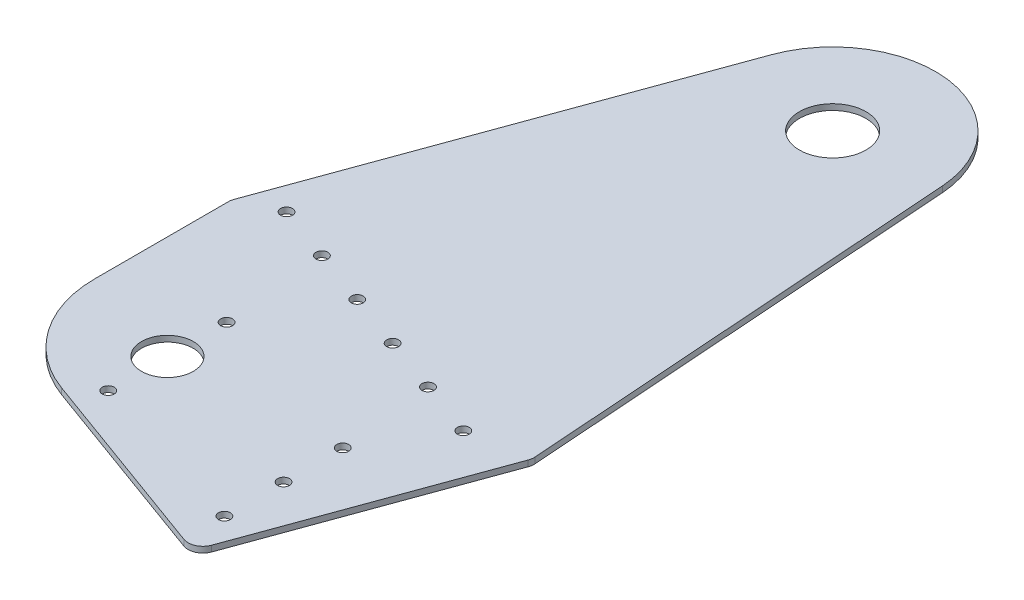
SolidWorks part; units mm, degrees
ref_plane "Front Plane" through (0, 0, 0) normal (0, 0, 1) x (1, 0, 0)
ref_plane "Top Plane" through (0, 0, 0) normal (0, 1, 0) x (1, 0, 0)
ref_plane "Right Plane" through (0, 0, 0) normal (1, 0, 0) x (0, 0, -1)
sketch "Sketch1" plane through (0, 0, 0) normal (0, 1, 0) x (1, 0, 0)
  line L2 (0, 79.9615) -> (0, 137.226)
  line L3 (160.847, 106.8323) -> (8.6873, 162.2139) construction
  line L9 (124.1351, 5.967) -> (160.3844, 105.5611)
  line L11 (0, 138.3457) -> (152.1597, 82.9641) construction
  line L12 (4.3437, 150.2798) -> (156.5034, 94.8982) construction
  line L13 (116.079, 82.9641) -> (116.079, 0) construction
  line L14 (128.779, 6.7641) -> (103.379, 6.7641) construction
  line L15 (128.779, 6.7641) -> (128.779, 82.9641) construction
  line L16 (128.779, 82.9641) -> (103.379, 82.9641) construction
  line L17 (103.379, 6.7641) -> (103.379, 82.9641) construction
  line L18 (128.779, 6.7641) -> (103.379, 82.9641) construction
  line L19 (128.779, 82.9641) -> (103.379, 6.7641) construction
  line L20 (0.383, 139.3979) -> (8.6873, 162.2139)
  line L21 (8.6873, 162.2139) -> (61.8971, 308.4066)
  line L22 (147.4128, 296.4285) -> (160.7514, 108.1817)
  line L23 (33.4254, 32.2252) -> (115.9962, 2.1718)
  line L24 (0, 0) -> (121.9633, 0) construction
  circle A0 centre (103.379, 293.3084) radius 14.2875
  circle A1 centre (44.45, 66.6217) radius 11.1125
  circle A2 centre (44.45, 66.6217) radius 25.4 construction
  circle A3 centre (44.45, 92.0217) radius 2.5527
  circle A4 centre (44.45, 41.2217) radius 2.5527
  circle A5 centre (44.45, 66.6217) radius 31.75 construction
  arc A6 (147.4128, 296.4285) -> (61.8971, 308.4066) centre (103.379, 293.3084) ccw
  arc A9 (0.383, 139.3979) -> (0, 137.226) centre (6.35, 137.226) ccw
  arc A10 (160.3844, 105.5611) -> (160.7514, 108.1817) centre (154.4173, 107.7329) ccw
  arc A11 (115.9962, 2.1718) -> (124.1351, 5.967) centre (118.168, 8.1389) ccw
  arc A12 (0, 79.9615) -> (33.4254, 32.2252) centre (50.8, 79.9615) ccw
  point P3 (111.7505, 111.1869)
  point P14 (135.6187, 102.4996)
  point P20 (116.079, 44.8641)
  point P24 (87.8823, 119.8742)
  point P26 (64.0141, 128.5615)
  point P28 (40.1459, 137.2488)
  point P29 (116.079, 19.4641)
  point P32 (16.2778, 145.9362)
  point P42 (0, 0)
  point P49 (116.079, 70.2641)
  dimension "D2" = 28.575
  dimension "D3" = 22.225
  dimension "D4" = 50.8
  dimension "D5" = 5.1054
  dimension "D21" = 63.5
  dimension "D22" = 6.35
  dimension "D26" = 50.8
  dimension "D6" = 20
  dimension "D7" = 25.4
  dimension "D8" = 23.3807
  dimension "D9" = 161.925
  dimension "D10" = 25.4
  dimension "D11" = 12.7
  dimension "D12" = 155.575
  dimension "D13" = 25.4
  dimension "D14" = 25.4
  dimension "D15" = 25.4
  dimension "D16" = 25.4
  dimension "D17" = 234.221
  dimension "D18" = 44.45
  dimension "D19" = 25.4
  dimension "D20" = 76.2
  dimension "D23" = 25.4
  dimension "D24" = 25.4
  dimension "D25" = 12.7
  dimension "D27" = 77.5957
extrude "Boss-Extrude1" add sketch "Sketch1" along normal blind 2.54
hole_wizard "#7 (0.201) Diameter Hole1" positions "Sketch2" profile "Sketch3" hole size "#7" standard "ANSI Inch"
sketch "Sketch2" plane through (0, 0, 0) normal (0, -1, 0) x (-1, 0, 0)
  point P0 (-135.6187, 102.4996)
  point P3 (-111.7505, 111.1869)
  point P6 (-87.8823, 119.8742)
  point P9 (-64.0141, 128.5615)
  point P12 (-40.1459, 137.2488)
  point P15 (-16.2778, 145.9362)
  point P18 (-116.079, 70.2641)
  point P21 (-116.079, 44.8641)
  point P24 (-116.079, 19.4641)
sketch "Sketch3" plane through (135.6187, 0, -102.4996) normal (1, 0, 0) x (0, 0, -1)
  line L0 (0, 0) -> (0, 2.54)
  line L1 (0, 2.54) -> (2.5527, 2.54)
  line L2 (2.5527, 2.54) -> (2.5527, 0)
  line L5 (2.5527, 0) -> (0, 0)
  line L11 (0, -6.35) -> (0, 107.95) construction
  dimension "Thru Hole Dia." = 5.1054
  dimension "Thru Hole Depth" = 2.54
sketch "Sketch7" [suppressed] plane through (0, 3.175, 0) normal (0, 1, 0) x (1, 0, 0)
  line L0 (62.0761, 169.3899) -> (62.5144, 170.567)
  line L1 (62.5144, 170.567) -> (61.5867, 170.2622)
  line L2 (66.9677, 175.195) -> (66.4796, 174.6886)
  line L3 (79.1731, 159.2722) -> (81.2123, 160.0556)
  line L4 (81.2123, 160.0556) -> (81.5639, 159.3016)
  line L5 (115.2098, 163.8413) -> (116.357, 163.4486)
  line L6 (116.357, 163.4486) -> (115.8813, 162.1889)
  line L7 (107.7827, 167.4695) -> (106.2875, 167.7994)
  line L8 (106.2875, 167.7994) -> (107.2664, 168.7114)
  line L9 (96.7548, 171.953) -> (96.1723, 172.7991)
  line L10 (96.1723, 172.7991) -> (95.6669, 171.9454)
  line L11 (100.3403, 166.7321) -> (97.6686, 163.2228)
  line L12 (89.4476, 166.3552) -> (91.3642, 168.2161)
  line L13 (91.3642, 168.2161) -> (90.6316, 168.886)
  line L14 (14.1169, 177.1315) -> (159.6183, 124.1733) construction
  line L15 (61.8971, 308.4066) -> (0.383, 139.3979) construction
  line L16 (160.7514, 108.1817) -> (147.4128, 296.4285) construction
  line L17 (33.4254, 32.2252) -> (115.9962, 2.1718) construction
  arc A0 (74.3082, 182.8504) -> (73.725, 182.5147) centre (74.7103, 181.4774) ccw
  arc A1 (73.725, 182.5147) -> (72.1718, 181.0017) centre (133.1992, 119.9033) ccw
  arc A2 (72.1718, 181.0017) -> (70.5314, 179.2921) centre (111.5899, 141.5378) ccw
  arc A3 (70.5314, 179.2921) -> (69.0762, 177.6244) centre (101.8392, 150.5038) ccw
  arc A4 (68.547, 177.0625) -> (69.0762, 177.6244) centre (64.4257, 181.474) ccw
  arc A5 (68.1985, 176.9514) -> (68.547, 177.0625) centre (68.2556, 177.3744) ccw
  arc A6 (67.7948, 177.1281) -> (68.1985, 176.9514) centre (68.3059, 177.7466) ccw
  arc A7 (66.8738, 177.9219) -> (67.7948, 177.1281) centre (86.4277, 199.6753) ccw
  arc A8 (66.8738, 177.9219) -> (65.9604, 178.4972) centre (64.7429, 175.5513) ccw
  arc A9 (65.9604, 178.4972) -> (64.9049, 178.7371) centre (64.7273, 175.5134) ccw
  arc A10 (64.9049, 178.7371) -> (63.6726, 178.6312) centre (64.6624, 174.336) ccw
  arc A11 (63.6726, 178.6312) -> (62.2317, 178.1778) centre (65.8385, 169.232) ccw
  arc A12 (62.2317, 178.1778) -> (60.6707, 177.4551) centre (68.6224, 162.3269) ccw
  arc A13 (60.6707, 177.4551) -> (59.5301, 176.703) centre (63.8858, 171.3384) ccw
  arc A14 (59.5301, 176.703) -> (58.5257, 175.7167) centre (64.2391, 170.9033) ccw
  arc A15 (58.5257, 175.7167) -> (57.3864, 174.2438) centre (75.6018, 161.3305) ccw
  arc A16 (56.7062, 173.3435) -> (57.3864, 174.2438) centre (42.2162, 184.9983) ccw
  arc A17 (56.1228, 172.7101) -> (56.7062, 173.3435) centre (51.6914, 177.3771) ccw
  arc A18 (55.5639, 172.2634) -> (56.1228, 172.7101) centre (53.2294, 175.7573) ccw
  arc A19 (54.9666, 171.9461) -> (55.5639, 172.2634) centre (53.6962, 175.0587) ccw
  arc A20 (54.5243, 171.7924) -> (54.9666, 171.9461) centre (53.293, 176.0466) ccw
  arc A21 (54.1163, 171.7066) -> (54.5243, 171.7924) centre (53.7472, 174.4772) ccw
  arc A22 (53.7901, 171.6904) -> (54.1163, 171.7066) centre (53.8553, 173.6659) ccw
  arc A23 (53.635, 171.7688) -> (53.7901, 171.6904) centre (53.7969, 171.8965) ccw
  arc A24 (53.5905, 172.1698) -> (53.635, 171.7688) centre (53.9344, 172.005) ccw
  arc A25 (54.0093, 172.8651) -> (53.5905, 172.1698) centre (57.4392, 170.3253) ccw
  arc A26 (54.9177, 173.9796) -> (54.0093, 172.8651) centre (66.4395, 163.6605) ccw
  arc A27 (56.8324, 176.0866) -> (54.9177, 173.9796) centre (201.8255, 42.4065) ccw
  arc A28 (56.8324, 176.0866) -> (58.6294, 178.1211) centre (10.0366, 219.2312) ccw
  arc A29 (58.6294, 178.1211) -> (59.308, 179.2325) centre (55.3883, 180.8631) ccw
  arc A30 (59.308, 179.2325) -> (59.3329, 180.0542) centre (58.2421, 179.6759) ccw
  arc A31 (59.3329, 180.0542) -> (58.8124, 180.8462) centre (57.5061, 179.4207) ccw
  arc A32 (58.8124, 180.8462) -> (57.7553, 181.5045) centre (56.5222, 178.3469) ccw
  arc A33 (57.7553, 181.5045) -> (56.6586, 181.6278) centre (56.9757, 179.5081) ccw
  arc A34 (56.6586, 181.6278) -> (55.3092, 181.1821) centre (57.2782, 177.4858) ccw
  arc A35 (55.3092, 181.1821) -> (53.3754, 180.0329) centre (66.6249, 159.9392) ccw
  arc A36 (50.4555, 178.11) -> (53.3754, 180.0329) centre (-1623.116, 2722.5471) ccw
  arc A37 (49.9624, 177.8143) -> (50.4555, 178.11) centre (46.648, 183.8988) ccw
  arc A38 (49.9101, 177.875) -> (49.9624, 177.8143) centre (49.9428, 177.8503) ccw
  arc A39 (50.3128, 178.3647) -> (49.9101, 177.875) centre (56.008, 173.2696) ccw
  arc A40 (50.6868, 178.776) -> (50.3128, 178.3647) centre (76.0211, 155.3656) ccw
  arc A41 (51.2355, 179.3665) -> (50.6868, 178.776) centre (157.5463, 80.0316) ccw
  arc A42 (51.843, 180.0132) -> (51.2355, 179.3665) centre (169.196, 69.1464) ccw
  arc A43 (52.4254, 180.6256) -> (51.843, 180.0132) centre (148.4427, 88.7526) ccw
  arc A44 (52.4254, 180.6256) -> (53.4057, 181.7377) centre (39.3118, 193.1732) ccw
  arc A45 (53.4057, 181.7377) -> (53.5985, 182.3391) centre (52.73, 182.286) ccw
  arc A46 (53.5985, 182.3391) -> (53.3133, 182.8365) centre (52.9532, 182.2996) ccw
  arc A47 (53.3133, 182.8365) -> (52.2525, 183.4524) centre (48.0293, 174.9565) ccw
  arc A48 (52.2525, 183.4524) -> (51.5201, 183.784) centre (47.2947, 173.4787) ccw
  arc A49 (51.5201, 183.784) -> (51.1138, 183.8533) centre (51.1621, 182.911) ccw
  arc A50 (51.1138, 183.8533) -> (50.7464, 183.7367) centre (51.1527, 183.0936) ccw
  arc A51 (50.7464, 183.7367) -> (50.2, 183.3471) centre (53.9544, 178.6599) ccw
  arc A52 (50.2, 183.3471) -> (49.7518, 182.9327) centre (52.8985, 179.9782) ccw
  arc A53 (49.7518, 182.9327) -> (49.0516, 182.1629) centre (73.6142, 160.5277) ccw
  arc A54 (49.0516, 182.1629) -> (48.2702, 181.2458) centre (76.593, 157.9039) ccw
  arc A55 (48.2702, 181.2458) -> (47.5086, 180.2915) centre (78.2622, 156.5282) ccw
  arc A56 (46.4851, 179.0185) -> (47.5086, 180.2915) centre (14.0592, 206.1378) ccw
  arc A57 (45.7613, 178.2653) -> (46.4851, 179.0185) centre (40.6676, 183.884) ccw
  arc A58 (45.0854, 177.7635) -> (45.7613, 178.2653) centre (42.8654, 181.4597) ccw
  arc A59 (44.2716, 177.3569) -> (45.0854, 177.7635) centre (42.0649, 182.7925) ccw
  arc A60 (42.4079, 176.7566) -> (44.2716, 177.3569) centre (39.29, 189.6277) ccw
  arc A61 (40.9063, 176.6373) -> (42.4079, 176.7566) centre (41.2837, 181.3973) ccw
  arc A62 (39.9018, 176.9889) -> (40.9063, 176.6373) centre (41.0714, 178.7199) ccw
  arc A63 (39.431, 177.7408) -> (39.9018, 176.9889) centre (40.5148, 177.8961) ccw
  arc A64 (39.5246, 178.6802) -> (39.431, 177.7408) centre (41.3834, 178.0206) ccw
  arc A65 (40.1422, 180.1498) -> (39.5246, 178.6802) centre (52.749, 173.9875) ccw
  arc A66 (40.967, 181.6069) -> (40.1422, 180.1498) centre (52.5933, 174.0636) ccw
  arc A67 (41.8093, 182.6065) -> (40.967, 181.6069) centre (45.3757, 178.7465) ccw
  arc A68 (42.735, 183.3116) -> (41.8093, 182.6065) centre (45.9761, 178.0966) ccw
  arc A69 (43.9637, 183.9848) -> (42.735, 183.3116) centre (49.4769, 172.4638) ccw
  arc A70 (45.1396, 184.492) -> (43.9637, 183.9848) centre (51.0302, 169.2179) ccw
  arc A71 (45.4706, 184.3586) -> (45.1396, 184.492) centre (45.2337, 184.2481) ccw
  arc A72 (45.4918, 184.1987) -> (45.4706, 184.3586) centre (45.2267, 184.2448) ccw
  arc A73 (45.4167, 183.8436) -> (45.4918, 184.1987) centre (40.5531, 185.0579) ccw
  arc A74 (45.2918, 183.4176) -> (45.4167, 183.8436) centre (40.1115, 185.1681) ccw
  arc A75 (45.1216, 182.9606) -> (45.2918, 183.4176) centre (37.7577, 185.9635) ccw
  arc A76 (44.6747, 182.1439) -> (45.1216, 182.9606) centre (41.315, 184.5129) ccw
  arc A77 (44.0662, 181.4742) -> (44.6747, 182.1439) centre (41.6698, 184.2628) ccw
  arc A78 (43.3406, 180.9981) -> (44.0662, 181.4742) centre (41.872, 184.0274) ccw
  arc A79 (42.5496, 180.7503) -> (43.3406, 180.9981) centre (42.1132, 183.5299) ccw
  arc A80 (42.5496, 180.7503) -> (42.0333, 180.6322) centre (43.1444, 176.9613) ccw
  arc A81 (42.0333, 180.6322) -> (41.6424, 180.4565) centre (42.5179, 179.0313) ccw
  arc A82 (41.6424, 180.4565) -> (41.3631, 180.2173) centre (42.2562, 179.4572) ccw
  arc A83 (41.3631, 180.2173) -> (41.1817, 179.91) centre (42.1574, 179.5413) ccw
  arc A84 (41.1817, 179.91) -> (41.3098, 179.5404) centre (41.4675, 179.802) ccw
  arc A85 (41.3098, 179.5404) -> (42.0184, 179.2356) centre (42.7766, 181.9744) ccw
  arc A86 (42.0184, 179.2356) -> (42.9911, 179.0785) centre (43.2169, 183.5653) ccw
  arc A87 (42.9911, 179.0785) -> (43.9333, 179.1484) centre (43.1825, 182.8819) ccw
  arc A88 (43.9333, 179.1484) -> (44.9037, 179.5156) centre (43.3041, 182.2773) ccw
  arc A89 (44.9037, 179.5156) -> (45.7482, 180.1858) centre (43.0455, 182.7238) ccw
  arc A90 (45.7482, 180.1858) -> (46.4656, 181.1717) centre (42.1809, 183.5357) ccw
  arc A91 (46.4656, 181.1717) -> (47.0588, 182.4767) centre (38.3652, 185.6409) ccw
  arc A92 (47.0588, 182.4767) -> (47.3717, 183.6741) centre (40.8285, 184.7444) ccw
  arc A93 (47.3717, 183.6741) -> (47.3128, 184.5787) centre (45.3846, 183.9991) ccw
  arc A94 (47.3128, 184.5787) -> (46.8711, 185.315) centre (45.6402, 184.0759) ccw
  arc A95 (46.8711, 185.315) -> (46.0042, 185.9854) centre (43.743, 182.166) ccw
  arc A96 (46.0042, 185.9854) -> (43.5248, 186.5796) centre (43.802, 182.2657) ccw
  arc A97 (43.5248, 186.5796) -> (40.6936, 185.808) centre (43.994, 179.2776) ccw
  arc A98 (40.6936, 185.808) -> (38.0435, 183.8254) centre (44.996, 177.2948) ccw
  arc A99 (38.0435, 183.8254) -> (36.1073, 180.9839) centre (46.1106, 176.2478) ccw
  arc A100 (35.7666, 180.3077) -> (36.1073, 180.9839) centre (22.1662, 187.5841) ccw
  arc A101 (35.4405, 179.7525) -> (35.7666, 180.3077) centre (28.6157, 184.1336) ccw
  arc A102 (35.1529, 179.3322) -> (35.4405, 179.7525) centre (28.1525, 184.4309) ccw
  arc A103 (35.0212, 179.292) -> (35.1529, 179.3322) centre (35.0603, 179.3996) ccw
  arc A104 (34.8987, 179.3634) -> (35.0212, 179.292) centre (35.1574, 179.6664) ccw
  arc A105 (34.7135, 179.5337) -> (34.8987, 179.3634) centre (37.1267, 181.9726) ccw
  arc A106 (34.5102, 179.7505) -> (34.7135, 179.5337) centre (37.4991, 182.3489) ccw
  arc A107 (34.3152, 179.9906) -> (34.5102, 179.7505) centre (38.0148, 182.7973) ccw
  arc A108 (34.3152, 179.9906) -> (33.9923, 180.3441) centre (32.2157, 178.3978) ccw
  arc A109 (33.9923, 180.3441) -> (33.1472, 181.1013) centre (-7.0589, 135.3727) ccw
  arc A110 (33.1472, 181.1013) -> (32.12, 181.9836) centre (-5.5235, 137.119) ccw
  arc A111 (32.12, 181.9836) -> (30.9902, 182.914) centre (-19.1906, 120.8302) ccw
  arc A112 (29.8644, 183.859) -> (30.9902, 182.914) centre (55.91, 213.7448) ccw
  arc A113 (28.849, 184.7853) -> (29.8644, 183.859) centre (49.7895, 206.7219) ccw
  arc A114 (28.0329, 185.5958) -> (28.849, 184.7853) centre (48.8821, 205.7713) ccw
  arc A115 (27.72, 186.0357) -> (28.0329, 185.5958) centre (29.3248, 186.846) ccw
  arc A116 (27.5634, 187.404) -> (27.72, 186.0357) centre (29.4953, 186.932) ccw
  arc A117 (28.2937, 188.8328) -> (27.5634, 187.404) centre (30.9404, 186.579) ccw
  arc A118 (29.9235, 190.2307) -> (28.2937, 188.8328) centre (33.5403, 184.365) ccw
  arc A119 (32.3635, 191.4887) -> (29.9235, 190.2307) centre (39.3462, 174.9492) ccw
  arc A120 (34.2055, 192.0999) -> (32.3635, 191.4887) centre (37.1375, 180.1808) ccw
  arc A121 (36.2347, 192.4587) -> (34.2055, 192.0999) centre (37.9264, 176.974) ccw
  arc A122 (38.0495, 192.5388) -> (36.2347, 192.4587) centre (37.761, 178.4879) ccw
  arc A123 (39.0536, 192.2197) -> (38.0495, 192.5388) centre (38.0113, 190.6797) ccw
  arc A124 (39.401, 191.9318) -> (39.0536, 192.2197) centre (37.7469, 190.289) ccw
  arc A125 (39.5146, 191.678) -> (39.401, 191.9318) centre (39.1218, 191.6545) ccw
  arc A126 (39.4565, 191.3418) -> (39.5146, 191.678) centre (38.7713, 191.6335) ccw
  arc A127 (39.1465, 190.6692) -> (39.4565, 191.3418) centre (27.8847, 196.2671) ccw
  arc A128 (38.0069, 188.9592) -> (39.1465, 190.6692) centre (31.8572, 194.2925) ccw
  arc A129 (36.3742, 187.4082) -> (38.0069, 188.9592) centre (29.1898, 196.6058) ccw
  arc A130 (34.4963, 186.2162) -> (36.3742, 187.4082) centre (29.3429, 196.4098) ccw
  arc A131 (32.6257, 185.5753) -> (34.4963, 186.2162) centre (31.2535, 192.6306) ccw
  arc A132 (32.6257, 185.5753) -> (32.326, 185.4734) centre (32.849, 184.4267) ccw
  arc A133 (32.326, 185.4734) -> (32.1971, 185.3132) centre (32.4364, 185.2526) ccw
  arc A134 (32.1971, 185.3132) -> (32.187, 185.0278) centre (32.8524, 185.1473) ccw
  arc A135 (32.187, 185.0278) -> (32.3205, 184.3701) centre (46.8553, 187.6615) ccw
  arc A136 (32.3205, 184.3701) -> (32.6327, 183.5397) centre (35.4909, 185.088) ccw
  arc A137 (32.6327, 183.5397) -> (33.1345, 182.9292) centre (34.4573, 184.5281) ccw
  arc A138 (33.1345, 182.9292) -> (33.7845, 182.5919) centre (34.2412, 184.2668) ccw
  arc A139 (33.7845, 182.5919) -> (34.5255, 182.546) centre (34.2659, 184.3575) ccw
  arc A140 (34.5255, 182.546) -> (36.1223, 183.2401) centre (34.0587, 185.8032) ccw
  arc A141 (36.1223, 183.2401) -> (38.2538, 185.2006) centre (22.3005, 200.4074) ccw
  arc A142 (38.2538, 185.2006) -> (40.2061, 187.5541) centre (22.1985, 200.5047) ccw
  arc A143 (40.2061, 187.5541) -> (41.3352, 189.6901) centre (33.0357, 192.7108) ccw
  arc A144 (41.3352, 189.6901) -> (41.6737, 191.3689) centre (35.9537, 191.6488) ccw
  arc A145 (41.6737, 191.3689) -> (41.4198, 192.8507) centre (38.2108, 191.5384) ccw
  arc A146 (41.4198, 192.8507) -> (40.543, 194.1499) centre (37.865, 191.397) ccw
  arc A147 (40.543, 194.1499) -> (39.0445, 195.2909) centre (35.0939, 188.5481) ccw
  arc A148 (39.0445, 195.2909) -> (36.5392, 195.9699) centre (36.5427, 191.021) ccw
  arc A149 (36.5392, 195.9699) -> (32.9739, 195.586) centre (36.5513, 179.1093) ccw
  arc A150 (32.9739, 195.586) -> (29.3635, 194.3985) centre (36.8595, 177.6898) ccw
  arc A151 (29.3635, 194.3985) -> (26.6543, 192.6008) centre (33.4359, 185.3211) ccw
  arc A152 (26.6543, 192.6008) -> (24.9307, 190.1375) centre (31.5632, 187.3313) ccw
  arc A153 (24.9307, 190.1375) -> (24.6835, 187.5211) centre (28.9468, 188.4382) ccw
  arc A154 (24.6835, 187.5211) -> (26.0207, 184.7839) centre (30.8844, 188.8551) ccw
  arc A155 (26.0207, 184.7839) -> (28.9405, 181.9734) centre (40.4964, 196.9008) ccw
  arc A156 (29.9885, 181.128) -> (28.9405, 181.9734) centre (8.4014, 155.4417) ccw
  arc A157 (30.3575, 180.6787) -> (29.9885, 181.128) centre (28.9675, 179.9132) ccw
  arc A158 (30.3713, 180.3133) -> (30.3575, 180.6787) centre (30.0009, 180.4823) ccw
  arc A159 (30.0759, 179.9118) -> (30.3713, 180.3133) centre (29.2641, 180.8183) ccw
  arc A160 (28.5512, 179.2654) -> (30.0759, 179.9118) centre (28.3681, 181.8189) ccw
  arc A161 (25.8887, 179.3109) -> (28.5512, 179.2654) centre (27.4758, 194.2586) ccw
  arc A162 (23.2563, 179.8312) -> (25.8887, 179.3109) centre (27.4762, 194.2617) ccw
  arc A163 (21.8803, 180.7864) -> (23.2563, 179.8312) centre (23.9984, 182.369) ccw
  arc A164 (21.8803, 180.7864) -> (21.4146, 181.3746) centre (11.131, 172.7548) ccw
  arc A165 (21.4146, 181.3746) -> (21.194, 181.4707) centre (21.208, 181.2014) ccw
  arc A166 (21.194, 181.4707) -> (20.9847, 181.3519) centre (21.2079, 181.2022) ccw
  arc A167 (20.9847, 181.3519) -> (20.5852, 180.7185) centre (32.0578, 173.9268) ccw
  arc A168 (20.5852, 180.7185) -> (20.5596, 178.2742) centre (22.6871, 179.4742) ccw
  arc A169 (20.5596, 178.2742) -> (22.7566, 176.3693) centre (24.3256, 180.3983) ccw
  arc A170 (22.7566, 176.3693) -> (26.8636, 175.665) centre (26.5339, 186.0688) ccw
  arc A171 (26.8636, 175.665) -> (31.4496, 176.4875) centre (26.3557, 191.6925) ccw
  arc A172 (32.2098, 176.7264) -> (31.4496, 176.4875) centre (38.1788, 156.4012) ccw
  arc A173 (33.0182, 176.9497) -> (32.2098, 176.7264) centre (39.5156, 151.8489) ccw
  arc A174 (33.7585, 177.1285) -> (33.0182, 176.9497) centre (38.8624, 154.3726) ccw
  arc A175 (34.2819, 177.2207) -> (33.7585, 177.1285) centre (35.0169, 171.5178) ccw
  arc A176 (34.9396, 177.2772) -> (34.2819, 177.2207) centre (35.2749, 169.5161) ccw
  arc A177 (35.2649, 177.2034) -> (34.9396, 177.2772) centre (34.967, 176.6436) ccw
  arc A178 (35.5206, 176.9724) -> (35.2649, 177.2034) centre (34.9322, 176.5782) ccw
  arc A179 (35.9024, 176.3582) -> (35.5206, 176.9724) centre (26.6812, 171.0512) ccw
  arc A180 (35.9024, 176.3582) -> (36.9988, 175.1864) centre (38.9535, 178.1142) ccw
  arc A181 (36.9988, 175.1864) -> (38.571, 174.5314) centre (39.4525, 178.8615) ccw
  arc A182 (38.571, 174.5314) -> (40.5484, 174.4493) centre (39.8152, 180.6435) ccw
  arc A183 (40.5484, 174.4493) -> (42.8178, 174.9505) centre (39.1738, 186.0622) ccw
  arc A184 (43.3201, 175.1069) -> (42.8178, 174.9505) centre (48.2695, 158.3264) ccw
  arc A185 (43.7701, 175.2291) -> (43.3201, 175.1069) centre (46.3835, 164.7208) ccw
  arc A186 (44.1476, 175.3175) -> (43.7701, 175.2291) centre (47.1628, 161.587) ccw
  arc A187 (44.2628, 175.3098) -> (44.1476, 175.3175) centre (44.192, 175.1153) ccw
  arc A188 (44.3107, 175.241) -> (44.2628, 175.3098) centre (44.2379, 175.2415) ccw
  arc A189 (44.2954, 175.0356) -> (44.3107, 175.241) centre (42.7889, 175.2514) ccw
  arc A190 (44.2393, 174.7674) -> (44.2954, 175.0356) centre (42.1713, 175.3398) ccw
  arc A191 (44.1412, 174.4607) -> (44.2393, 174.7674) centre (40.311, 175.8548) ccw
  arc A192 (44.1412, 174.4607) -> (44.0089, 173.708) centre (46.203, 173.7103) ccw
  arc A193 (44.0089, 173.708) -> (44.1385, 172.9419) centre (46.3511, 173.7104) ccw
  arc A194 (44.1385, 172.9419) -> (44.5028, 172.2883) centre (46.1785, 173.6505) ccw
  arc A195 (44.5028, 172.2883) -> (45.0452, 171.8581) centre (45.7458, 173.2987) ccw
  arc A196 (45.0452, 171.8581) -> (45.5046, 171.7887) centre (45.3862, 172.5592) ccw
  arc A197 (45.5046, 171.7887) -> (46.0003, 171.9763) centre (45.311, 173.0486) ccw
  arc A198 (46.0003, 171.9763) -> (46.7213, 172.5276) centre (42.9825, 176.6707) ccw
  arc A199 (46.7213, 172.5276) -> (48.1908, 173.8802) centre (-21.0634, 247.6437) ccw
  arc A200 (49.9531, 175.4754) -> (48.1908, 173.8802) centre (92.8617, 126.3005) ccw
  arc A201 (51.74, 176.975) -> (49.9531, 175.4754) centre (89.7982, 129.8115) ccw
  arc A202 (53.4092, 178.3032) -> (51.74, 176.975) centre (149.5534, 55.76) ccw
  arc A203 (53.7366, 178.3554) -> (53.4092, 178.3032) centre (53.6199, 178.0346) ccw
  arc A204 (53.756, 178.2996) -> (53.7366, 178.3554) centre (53.7236, 178.3196) ccw
  arc A205 (53.4455, 177.8028) -> (53.756, 178.2996) centre (14.1169, 202.725) ccw
  arc A206 (53.0612, 177.2191) -> (53.4455, 177.8028) centre (36.5165, 188.5306) ccw
  arc A207 (52.5822, 176.5337) -> (53.0612, 177.2191) centre (19.3352, 200.2773) ccw
  arc A208 (52.5822, 176.5337) -> (51.6189, 175.0333) centre (67.2678, 166.0458) ccw
  arc A209 (51.6189, 175.0333) -> (50.8843, 173.5493) centre (63.2726, 168.3404) ccw
  arc A210 (50.8843, 173.5493) -> (50.4332, 172.233) centre (60.3416, 169.5728) ccw
  arc A211 (50.4332, 172.233) -> (50.3764, 171.2877) centre (52.709, 171.622) ccw
  arc A212 (50.3764, 171.2877) -> (50.8293, 170.4134) centre (51.8564, 171.4998) ccw
  arc A213 (50.8293, 170.4134) -> (51.7794, 169.8973) centre (52.2752, 171.9427) ccw
  arc A214 (51.7794, 169.8973) -> (53.1461, 169.8276) centre (52.647, 173.4767) ccw
  arc A215 (53.1461, 169.8276) -> (54.7542, 170.2266) centre (52.0974, 177.4948) ccw
  arc A216 (55.3189, 170.4157) -> (54.7542, 170.2266) centre (58.4979, 159.9846) ccw
  arc A217 (55.6177, 170.4524) -> (55.3189, 170.4157) centre (55.573, 169.5819) ccw
  arc A218 (55.7691, 170.3669) -> (55.6177, 170.4524) centre (55.6077, 170.2581) ccw
  arc A219 (55.8258, 170.1715) -> (55.7691, 170.3669) centre (55.4927, 170.1806) ccw
  arc A220 (55.8258, 170.1715) -> (55.8514, 169.9319) centre (56.7312, 170.1468) ccw
  arc A221 (55.8514, 169.9319) -> (55.9579, 169.5508) centre (61.6551, 171.3493) ccw
  arc A222 (55.9579, 169.5508) -> (56.1102, 169.1191) centre (62.5193, 171.6221) ccw
  arc A223 (56.1102, 169.1191) -> (56.2928, 168.6924) centre (62.8661, 171.7576) ccw
  arc A224 (56.2928, 168.6924) -> (57.4829, 167.4515) centre (58.71, 169.8196) ccw
  arc A225 (57.4829, 167.4515) -> (59.2339, 167.1346) centre (58.8722, 170.1326) ccw
  arc A226 (59.2339, 167.1346) -> (60.9662, 167.8594) centre (58.8215, 170.5531) ccw
  arc A227 (60.9662, 167.8594) -> (62.0761, 169.3899) centre (58.7665, 170.6222) ccw
  arc A228 (60.6138, 170.7928) -> (61.5867, 170.2622) centre (61.3494, 170.9844) ccw
  arc A229 (60.8154, 172.4171) -> (60.6138, 170.7928) centre (62.7575, 171.3513) ccw
  arc A230 (62.6398, 174.8337) -> (60.8154, 172.4171) centre (70.0177, 167.367) ccw
  arc A231 (64.8718, 176.2485) -> (62.6398, 174.8337) centre (67.003, 170.418) ccw
  arc A232 (65.3282, 176.4029) -> (64.8718, 176.2485) centre (68.2976, 166.8761) ccw
  arc A233 (65.749, 176.5194) -> (65.3282, 176.4029) centre (67.3605, 169.8827) ccw
  arc A234 (66.1032, 176.5955) -> (65.749, 176.5194) centre (67.3446, 169.9483) ccw
  arc A235 (66.2518, 176.5832) -> (66.1032, 176.5955) centre (66.1551, 176.3175) ccw
  arc A236 (66.44, 176.4345) -> (66.2518, 176.5832) centre (66.1213, 176.2247) ccw
  arc A237 (66.7316, 175.9559) -> (66.44, 176.4345) centre (59.7592, 172.036) ccw
  arc A238 (66.9914, 175.457) -> (66.7316, 175.9559) centre (59.0868, 171.658) ccw
  arc A239 (67.0017, 175.2495) -> (66.9914, 175.457) centre (66.7501, 175.3411) ccw
  arc A240 (66.9677, 175.195) -> (67.0017, 175.2495) centre (66.8559, 175.3025) ccw
  arc A241 (65.9217, 174.1157) -> (66.4796, 174.6886) centre (-0.3358, 239.1998) ccw
  arc A242 (65.2645, 173.4503) -> (65.9217, 174.1157) centre (-57.3273, 295.182) ccw
  arc A243 (65.2645, 173.4503) -> (64.0677, 172.1499) centre (81.8084, 157.0225) ccw
  arc A244 (64.0677, 172.1499) -> (63.4286, 171.1774) centre (67.6274, 169.1145) ccw
  arc A245 (63.4286, 171.1774) -> (63.0742, 170.1165) centre (67.1785, 169.3351) ccw
  arc A246 (63.0742, 170.1165) -> (62.8538, 168.5433) centre (79.0298, 167.0787) ccw
  arc A247 (62.8538, 168.5433) -> (62.9704, 166.7394) centre (68.6902, 168.0148) ccw
  arc A248 (62.9704, 166.7394) -> (63.6889, 165.5617) centre (65.0575, 167.2048) ccw
  arc A249 (63.6889, 165.5617) -> (64.9741, 165.071) centre (65.0485, 167.194) ccw
  arc A250 (64.9741, 165.071) -> (66.7601, 165.2889) centre (65.1764, 170.8417) ccw
  arc A251 (67.3237, 165.441) -> (66.7601, 165.2889) centre (72.4207, 145.443) ccw
  arc A252 (67.8029, 165.5512) -> (67.3237, 165.441) centre (69.904, 155.3172) ccw
  arc A253 (68.2017, 165.6286) -> (67.8029, 165.5512) centre (71.5525, 147.2877) ccw
  arc A254 (68.2539, 165.5956) -> (68.2017, 165.6286) centre (68.2099, 165.5838) ccw
  arc A255 (68.2632, 165.5138) -> (68.2539, 165.5956) centre (67.9851, 165.5235) ccw
  arc A256 (68.2486, 165.1392) -> (68.2632, 165.5138) centre (18.2975, 167.2726) ccw
  arc A257 (68.2263, 164.699) -> (68.2486, 165.1392) centre (40.5629, 166.3217) ccw
  arc A258 (68.1942, 164.1979) -> (68.2263, 164.699) centre (21.7421, 167.4257) ccw
  arc A259 (68.1942, 164.1979) -> (68.2557, 162.9509) centre (73.4553, 163.8323) ccw
  arc A260 (68.2557, 162.9509) -> (68.6061, 161.6871) centre (74.5732, 164.0218) ccw
  arc A261 (68.6061, 161.6871) -> (69.1861, 160.5706) centre (74.1315, 163.849) ccw
  arc A262 (69.1861, 160.5706) -> (69.9292, 159.7637) centre (72.0774, 162.4873) ccw
  arc A263 (69.9292, 159.7637) -> (71.0506, 159.11) centre (72.8077, 163.4132) ccw
  arc A264 (71.0506, 159.11) -> (72.6135, 158.5966) centre (75.4812, 169.9608) ccw
  arc A265 (72.6135, 158.5966) -> (74.2686, 158.2998) centre (75.5651, 170.2933) ccw
  arc A266 (74.2686, 158.2998) -> (75.6874, 158.3104) centre (74.932, 164.4372) ccw
  arc A267 (75.6874, 158.3104) -> (76.3847, 158.4332) centre (74.8472, 165.1251) ccw
  arc A268 (76.3847, 158.4332) -> (77.308, 158.6665) centre (71.4689, 179.8295) ccw
  arc A269 (77.308, 158.6665) -> (78.2865, 158.9591) centre (70.9596, 181.6752) ccw
  arc A270 (78.2865, 158.9591) -> (79.1731, 159.2722) centre (73.0176, 175.2945) ccw
  arc A271 (81.5639, 159.3016) -> (82.0723, 158.5817) centre (83.8133, 160.3506) ccw
  arc A272 (82.0723, 158.5817) -> (82.8503, 157.998) centre (84.6282, 161.1785) ccw
  arc A273 (82.8503, 157.998) -> (83.7221, 157.6587) centre (84.503, 160.9544) ccw
  arc A274 (83.7221, 157.6587) -> (84.5041, 157.658) centre (84.1145, 159.3147) ccw
  arc A275 (84.5041, 157.658) -> (84.898, 157.7963) centre (84.055, 159.5674) ccw
  arc A276 (84.898, 157.7963) -> (85.4779, 158.094) centre (80.2438, 167.5753) ccw
  arc A277 (85.4779, 158.094) -> (86.1162, 158.4718) centre (79.4906, 168.9396) ccw
  arc A278 (86.1162, 158.4718) -> (86.7275, 158.8854) centre (79.669, 168.6578) ccw
  arc A279 (87.2967, 159.2808) -> (86.7275, 158.8854) centre (97.7406, 143.6379) ccw
  arc A280 (87.8098, 159.6034) -> (87.2967, 159.2808) centre (93.4193, 150.1105) ccw
  arc A281 (88.2441, 159.8499) -> (87.8098, 159.6034) centre (95.1182, 147.2354) ccw
  arc A282 (88.3811, 159.8626) -> (88.2441, 159.8499) centre (88.3273, 159.6972) ccw
  arc A283 (88.4414, 159.7807) -> (88.3811, 159.8626) centre (88.3541, 159.7795) ccw
  arc A284 (88.427, 159.5386) -> (88.4414, 159.7807) centre (86.7915, 159.7576) ccw
  arc A285 (88.3624, 159.22) -> (88.427, 159.5386) centre (86.0178, 159.8612) ccw
  arc A286 (88.2462, 158.8546) -> (88.3624, 159.22) centre (83.8571, 160.4521) ccw
  arc A287 (88.2462, 158.8546) -> (88.1272, 158.3962) centre (90.5899, 158.0016) ccw
  arc A288 (88.1272, 158.3962) -> (88.0913, 157.9067) centre (90.9602, 157.9422) ccw
  arc A289 (88.0913, 157.9067) -> (88.1393, 157.4142) centre (91.0105, 157.9429) ccw
  arc A290 (88.1393, 157.4142) -> (88.2697, 156.946) centre (90.8101, 157.906) ccw
  arc A291 (88.2697, 156.946) -> (88.5079, 156.4198) centre (92.5095, 158.5481) ccw
  arc A292 (88.5079, 156.4198) -> (88.7537, 156.1203) centre (89.3753, 156.8811) ccw
  arc A293 (88.7537, 156.1203) -> (89.0958, 155.9389) centre (89.378, 156.8844) ccw
  arc A294 (89.0958, 155.9389) -> (89.6608, 155.8086) centre (90.4086, 160.338) ccw
  arc A295 (89.6608, 155.8086) -> (90.1565, 155.7817) centre (90.0307, 158.0495) ccw
  arc A296 (90.1565, 155.7817) -> (90.8132, 155.8497) centre (89.7737, 162.6832) ccw
  arc A297 (90.8132, 155.8497) -> (91.5106, 155.9893) centre (89.6645, 163.4011) ccw
  arc A298 (91.5106, 155.9893) -> (92.1441, 156.1863) centre (90.1128, 161.6014) ccw
  arc A299 (93.2212, 156.5738) -> (92.1441, 156.1863) centre (107.0085, 116.5611) ccw
  arc A300 (93.653, 156.6471) -> (93.2212, 156.5738) centre (93.6592, 155.3025) ccw
  arc A301 (93.8054, 156.5151) -> (93.653, 156.6471) centre (93.6537, 156.494) ccw
  arc A302 (93.7714, 156.1938) -> (93.8054, 156.5151) centre (93.1422, 156.4228) ccw
  arc A303 (93.7714, 156.1938) -> (93.7529, 155.6122) centre (94.648, 155.8748) ccw
  arc A304 (93.7529, 155.6122) -> (94.0829, 154.8096) centre (97.7329, 156.7795) ccw
  arc A305 (94.0829, 154.8096) -> (94.5832, 154.0778) centre (97.8126, 156.8225) ccw
  arc A306 (94.5832, 154.0778) -> (95.112, 153.71) centre (95.5427, 154.8932) ccw
  arc A307 (95.112, 153.71) -> (96.1172, 153.5975) centre (95.8467, 155.7286) ccw
  arc A308 (96.1172, 153.5975) -> (97.5577, 153.9024) centre (94.9894, 162.4836) ccw
  arc A309 (97.5577, 153.9024) -> (99.0889, 154.4962) centre (94.5811, 163.8479) ccw
  arc A310 (99.0889, 154.4962) -> (100.4205, 155.2988) centre (95.4623, 162.0198) ccw
  arc A311 (100.4205, 155.2988) -> (101.005, 155.7598) centre (93.571, 164.5834) ccw
  arc A312 (101.005, 155.7598) -> (101.4861, 156.2055) centre (96.5124, 161.0922) ccw
  arc A313 (101.4861, 156.2055) -> (101.8369, 156.5933) centre (96.9623, 160.6501) ccw
  arc A314 (101.8369, 156.5933) -> (101.8862, 156.7905) centre (101.657, 156.743) ccw
  arc A315 (101.8862, 156.7905) -> (101.6772, 157.1413) centre (101.2743, 156.6636) ccw
  arc A316 (101.6772, 157.1413) -> (101.3093, 157.2626) centre (101.3422, 156.7441) ccw
  arc A317 (101.3093, 157.2626) -> (100.7828, 157.1091) centre (101.3888, 156.0107) ccw
  arc A318 (100.7828, 157.1091) -> (100.1358, 156.6795) centre (103.0724, 152.9588) ccw
  arc A319 (99.2924, 156.1129) -> (100.1358, 156.6795) centre (96.0217, 161.8922) ccw
  arc A320 (98.3794, 155.687) -> (99.2924, 156.1129) centre (96.1294, 161.7019) ccw
  arc A321 (97.5854, 155.4596) -> (98.3794, 155.687) centre (96.5488, 160.5808) ccw
  arc A322 (97.2265, 155.5913) -> (97.5854, 155.4596) centre (97.513, 155.8174) ccw
  arc A323 (97.1513, 156.3756) -> (97.2265, 155.5913) centre (97.7972, 156.0417) ccw
  arc A324 (98.3117, 158.4158) -> (97.1513, 156.3756) centre (123.2009, 142.9097) ccw
  arc A325 (100.0065, 160.8692) -> (98.3117, 158.4158) centre (125.0369, 141.7659) ccw
  arc A326 (102.1792, 163.5408) -> (100.0065, 160.8692) centre (144.3604, 127.018) ccw
  arc A327 (103.5171, 165.0485) -> (102.1792, 163.5408) centre (164.7872, 109.3315) ccw
  arc A328 (104.2773, 165.7708) -> (103.5171, 165.0485) centre (108.8368, 160.211) ccw
  arc A329 (104.8168, 166.0837) -> (104.2773, 165.7708) centre (105.5083, 164.2697) ccw
  arc A330 (105.2843, 166.0873) -> (104.8168, 166.0837) centre (105.0553, 165.458) ccw
  arc A331 (105.3465, 165.9273) -> (105.2843, 166.0873) centre (105.2453, 165.98) ccw
  arc A332 (105.0939, 165.5331) -> (105.3465, 165.9273) centre (103.0097, 167.1464) ccw
  arc A333 (104.5868, 164.9464) -> (105.0939, 165.5331) centre (99.4276, 169.919) ccw
  arc A334 (103.7536, 164.1096) -> (104.5868, 164.9464) centre (78.4434, 190.1439) ccw
  arc A335 (103.7536, 164.1096) -> (102.3738, 162.6584) centre (121.5081, 145.8473) ccw
  arc A336 (102.3738, 162.6584) -> (101.6815, 161.5964) centre (105.712, 159.7254) ccw
  arc A337 (101.6815, 161.5964) -> (101.4294, 160.5657) centre (104.1682, 160.4421) ccw
  arc A338 (101.4294, 160.5657) -> (101.5169, 159.2913) centre (107.0552, 160.3118) ccw
  arc A339 (101.5169, 159.2913) -> (102.0068, 157.7779) centre (107.5122, 160.396) ccw
  arc A340 (102.0068, 157.7779) -> (102.9056, 156.2974) centre (109.7048, 161.4387) ccw
  arc A341 (102.9056, 156.2974) -> (104.2497, 154.8037) centre (112.3119, 163.41) ccw
  arc A342 (104.2497, 154.8037) -> (106.0867, 153.2478) centre (120.7155, 172.3809) ccw
  arc A343 (107.1588, 152.2758) -> (106.0867, 153.2478) centre (100.8303, 146.373) ccw
  arc A344 (107.2427, 151.6389) -> (107.1588, 152.2758) centre (106.7543, 151.8985) ccw
  arc A345 (106.625, 151.1698) -> (107.2427, 151.6389) centre (106.4259, 152.0731) ccw
  arc A346 (104.8179, 150.8612) -> (106.625, 151.1698) centre (102.4977, 169.8959) ccw
  arc A347 (102.932, 150.7695) -> (104.8179, 150.8612) centre (103.2457, 163.759) ccw
  arc A348 (101.2302, 150.9765) -> (102.932, 150.7695) centre (103.146, 159.6295) ccw
  arc A349 (99.8263, 151.4569) -> (101.2302, 150.9765) centre (102.6676, 157.4686) ccw
  arc A350 (98.8346, 152.1859) -> (99.8263, 151.4569) centre (101.2015, 154.3666) ccw
  arc A351 (98.8346, 152.1859) -> (98.2533, 152.7414) centre (94.1824, 147.8996) ccw
  arc A352 (98.2533, 152.7414) -> (97.9025, 152.8128) centre (98.0124, 152.455) ccw
  arc A353 (97.9025, 152.8128) -> (97.6086, 152.5576) centre (98.0436, 152.3534) ccw
  arc A354 (97.6086, 152.5576) -> (97.2521, 151.7001) centre (106.9734, 148.1619) ccw
  arc A355 (97.2521, 151.7001) -> (97.5139, 149.4925) centre (99.5718, 150.8558) ccw
  arc A356 (97.5139, 149.4925) -> (99.5568, 147.833) centre (101.185, 151.9245) ccw
  arc A357 (99.5568, 147.833) -> (103.1248, 147.1564) centre (103.0872, 156.7047) ccw
  arc A358 (103.1248, 147.1564) -> (107.3336, 147.6883) centre (103.0561, 164.6175) ccw
  arc A359 (107.3336, 147.6883) -> (108.1157, 147.8984) centre (100.7179, 173.8716) ccw
  arc A360 (108.1157, 147.8984) -> (108.8582, 148.1237) centre (101.8914, 169.7516) ccw
  arc A361 (108.8582, 148.1237) -> (109.4811, 148.3352) centre (102.4455, 168.0313) ccw
  arc A362 (109.4811, 148.3352) -> (109.7929, 148.4805) centre (108.8578, 150.0801) ccw
  arc A363 (110.551, 148.7041) -> (109.7929, 148.4805) centre (110.6245, 147.058) ccw
  arc A364 (111.4377, 148.592) -> (110.551, 148.7041) centre (110.6686, 146.0707) ccw
  arc A365 (112.3117, 148.1686) -> (111.4377, 148.592) centre (110.5204, 145.5849) ccw
  arc A366 (113.0306, 147.4929) -> (112.3117, 148.1686) centre (110.4085, 145.4234) ccw
  arc A367 (113.0306, 147.4929) -> (114.0876, 146.5636) centre (116.0922, 149.9093) ccw
  arc A368 (114.0876, 146.5636) -> (115.4418, 146.0301) centre (116.3711, 150.3749) ccw
  arc A369 (115.4418, 146.0301) -> (117.0635, 145.9201) centre (116.6348, 151.6077) ccw
  arc A370 (117.0635, 145.9201) -> (118.9045, 146.2365) centre (116.3233, 155.7421) ccw
  arc A371 (119.6917, 146.4433) -> (118.9045, 146.2365) centre (131.9567, 98.1706) ccw
  arc A372 (120.3794, 146.609) -> (119.6917, 146.4433) centre (126.7001, 118.8596) ccw
  arc A373 (120.9676, 146.7397) -> (120.3794, 146.609) centre (133.1775, 90.4219) ccw
  arc A374 (121.0804, 146.7321) -> (120.9676, 146.7397) centre (121.0107, 146.5407) ccw
  arc A375 (121.1231, 146.6671) -> (121.0804, 146.7321) centre (121.0581, 146.6709) ccw
  arc A376 (121.0986, 146.4529) -> (121.1231, 146.6671) centre (119.1481, 146.784) ccw
  arc A377 (121.0356, 146.1763) -> (121.0986, 146.4529) centre (118.6024, 146.8766) ccw
  arc A378 (120.9321, 145.8584) -> (121.0356, 146.1763) centre (116.3671, 147.5199) ccw
  arc A379 (120.9321, 145.8584) -> (120.8158, 145.1098) centre (122.7691, 145.1898) ccw
  arc A380 (120.8158, 145.1098) -> (120.9839, 144.3398) centre (123.0909, 145.2029) ccw
  arc A381 (120.9839, 144.3398) -> (121.3948, 143.698) centre (122.9451, 145.1432) ccw
  arc A382 (121.3948, 143.698) -> (121.9741, 143.3145) centre (122.4829, 144.7123) ccw
  arc A383 (121.9741, 143.3145) -> (122.4116, 143.2933) centre (122.227, 144.0094) ccw
  arc A384 (122.4116, 143.2933) -> (122.903, 143.5132) centre (122.0109, 144.8479) ccw
  arc A385 (122.903, 143.5132) -> (123.5919, 144.0558) centre (119.7757, 148.1925) ccw
  arc A386 (123.5919, 144.0558) -> (124.811, 145.2104) centre (80.2806, 191.0049) ccw
  arc A387 (126.4824, 146.7421) -> (124.811, 145.2104) centre (151.5098, 117.7536) ccw
  arc A388 (128.4014, 148.3252) -> (126.4824, 146.7421) centre (162.7367, 104.7499) ccw
  arc A389 (130.2861, 149.7873) -> (128.4014, 148.3252) centre (225.7864, 24.7328) ccw
  arc A390 (130.5402, 149.7248) -> (130.2861, 149.7873) centre (130.388, 149.6538) ccw
  arc A391 (130.535, 149.6327) -> (130.5402, 149.7248) centre (130.4519, 149.6836) ccw
  arc A392 (130.2239, 149.1328) -> (130.535, 149.6327) centre (93.2029, 172.5145) ccw
  arc A393 (129.8432, 148.5525) -> (130.2239, 149.1328) centre (113.206, 159.8809) ccw
  arc A394 (129.3801, 147.888) -> (129.8432, 148.5525) centre (99.0798, 169.4996) ccw
  arc A395 (129.3801, 147.888) -> (128.2705, 146.1509) centre (145.8021, 136.1751) ccw
  arc A396 (128.2705, 146.1509) -> (127.5947, 144.6382) centre (135.6907, 141.9286) ccw
  arc A397 (127.5947, 144.6382) -> (127.3428, 143.3653) centre (132.4287, 143.0204) ccw
  arc A398 (127.3428, 143.3653) -> (127.5302, 142.3605) centre (129.3875, 143.2266) ccw
  arc A399 (127.5302, 142.3605) -> (128.0096, 141.6309) centre (130.2673, 143.6369) ccw
  arc A400 (128.0096, 141.6309) -> (128.5887, 141.2752) centre (128.8878, 142.4112) ccw
  arc A401 (128.5887, 141.2752) -> (129.4221, 141.2292) centre (129.1175, 143.2836) ccw
  arc A402 (129.4221, 141.2292) -> (130.7955, 141.5008) centre (127.2837, 155.6505) ccw
  arc A403 (131.888, 141.7559) -> (130.7955, 141.5008) centre (140.5263, 102.2936) ccw
  arc A404 (132.3361, 141.7843) -> (131.888, 141.7559) centre (132.2048, 140.3084) ccw
  arc A405 (132.5874, 141.6517) -> (132.3361, 141.7843) centre (132.3035, 141.4182) ccw
  arc A406 (132.763, 141.3258) -> (132.5874, 141.6517) centre (131.8466, 141.0423) ccw
  arc A407 (132.8313, 141.0753) -> (132.763, 141.3258) centre (129.1022, 140.1931) ccw
  arc A408 (132.879, 140.8317) -> (132.8313, 141.0753) centre (129.7231, 140.34) ccw
  arc A409 (132.9034, 140.624) -> (132.879, 140.8317) centre (130.1475, 140.4061) ccw
  arc A410 (132.8903, 140.5089) -> (132.9034, 140.624) centre (132.6008, 140.6001) ccw
  arc A411 (132.8903, 140.5089) -> (132.9018, 140.3909) centre (133.0347, 140.4634) ccw
  arc A412 (132.9018, 140.3909) -> (133.0489, 140.1464) centre (135.8719, 142.0106) ccw
  arc A413 (133.0489, 140.1464) -> (133.2585, 139.8593) centre (136.2011, 142.228) ccw
  arc A414 (133.2585, 139.8593) -> (133.5189, 139.557) centre (137.9184, 143.6104) ccw
  arc A415 (133.5189, 139.557) -> (134.2995, 138.9517) centre (135.707, 141.5729) ccw
  arc A416 (134.2995, 138.9517) -> (135.2053, 138.6656) centre (135.5093, 141.2048) ccw
  arc A417 (135.2053, 138.6656) -> (136.2197, 138.7178) centre (135.5609, 141.6359) ccw
  arc A418 (136.2197, 138.7178) -> (137.3169, 139.1023) centre (135.1036, 143.6614) ccw
  arc A419 (137.3169, 139.1023) -> (138.0201, 139.479) centre (132.9395, 148.1192) ccw
  arc A420 (138.0201, 139.479) -> (138.3834, 139.7853) centre (137.3042, 140.6965) ccw
  arc A421 (138.3834, 139.7853) -> (138.5926, 140.1675) centre (137.5468, 140.4916) ccw
  arc A422 (138.5926, 140.1675) -> (138.7389, 140.7863) centre (134.153, 141.5435) ccw
  arc A423 (138.7389, 140.7863) -> (138.808, 141.308) centre (130.6179, 142.1271) ccw
  arc A424 (138.808, 141.308) -> (138.7847, 141.5843) centre (138.053, 141.3835) ccw
  arc A425 (138.7847, 141.5843) -> (138.6769, 141.6886) centre (138.6426, 141.5453) ccw
  arc A426 (138.6769, 141.6886) -> (138.4963, 141.6704) centre (138.6127, 141.4207) ccw
  arc A427 (137.9817, 141.557) -> (138.4963, 141.6704) centre (137.9847, 142.7675) ccw
  arc A428 (137.5318, 141.6973) -> (137.9817, 141.557) centre (137.9837, 142.3547) ccw
  arc A429 (137.2454, 142.064) -> (137.5318, 141.6973) centre (137.9698, 142.3345) ccw
  arc A430 (137.1801, 142.575) -> (137.2454, 142.064) centre (138.3027, 142.4588) ccw
  arc A431 (137.5883, 143.8715) -> (137.1801, 142.575) centre (140.5519, 142.226) ccw
  arc A432 (138.5791, 145.3017) -> (137.5883, 143.8715) centre (145.2823, 139.5994) ccw
  arc A433 (139.9325, 146.6198) -> (138.5791, 145.3017) centre (146.2686, 138.7604) ccw
  arc A434 (141.4471, 147.591) -> (139.9325, 146.6198) centre (145.1544, 140.1425) ccw
  arc A435 (142.3111, 147.9398) -> (141.4471, 147.591) centre (144.1066, 142.2476) ccw
  arc A436 (142.955, 147.9946) -> (142.3111, 147.9398) centre (142.7553, 146.5315) ccw
  arc A437 (143.4171, 147.7688) -> (142.955, 147.9946) centre (142.8441, 147.1819) ccw
  arc A438 (143.7313, 147.2792) -> (143.4171, 147.7688) centre (142.5136, 146.8434) ccw
  arc A439 (143.7607, 146.9225) -> (143.7313, 147.2792) centre (143.0791, 147.0458) ccw
  arc A440 (143.6153, 146.5573) -> (143.7607, 146.9225) centre (142.7876, 147.0985) ccw
  arc A441 (143.2327, 146.08) -> (143.6153, 146.5573) centre (140.9642, 148.2906) ccw
  arc A442 (142.4217, 145.2762) -> (143.2327, 146.08) centre (119.6743, 169.0375) ccw
  arc A443 (142.4217, 145.2762) -> (141.6908, 144.5264) centre (152.8814, 134.3502) ccw
  arc A444 (141.6908, 144.5264) -> (141.1432, 143.8471) centre (147.1275, 139.5826) ccw
  arc A445 (141.1432, 143.8471) -> (140.7302, 143.1757) centre (145.8905, 140.4641) ccw
  arc A446 (140.7302, 143.1757) -> (140.4116, 142.4556) centre (145.9068, 140.4555) ccw
  arc A447 (140.4116, 142.4556) -> (139.748, 139.6846) centre (152.1795, 138.1724) ccw
  arc A448 (139.748, 139.6846) -> (140.0975, 137.6829) centre (143.2294, 139.2611) ccw
  arc A449 (140.0975, 137.6829) -> (141.3576, 136.6688) centre (141.8441, 138.563) ccw
  arc A450 (141.3576, 136.6688) -> (143.3249, 136.6742) centre (142.3307, 140.458) ccw
  arc A451 (143.3249, 136.6742) -> (144.5147, 137.1172) centre (141.6998, 142.8589) ccw
  arc A452 (144.5147, 137.1172) -> (145.9272, 137.898) centre (137.2908, 151.8524) ccw
  arc A453 (145.9272, 137.898) -> (147.1896, 138.7529) centre (136.1468, 153.7007) ccw
  arc A454 (147.1896, 138.7529) -> (147.6251, 139.3356) centre (146.4406, 139.7668) ccw
  arc A455 (147.6251, 139.3356) -> (147.6255, 139.8245) centre (146.9521, 139.5806) ccw
  arc A456 (147.6255, 139.8245) -> (147.3123, 140.0372) centre (147.3221, 139.7146) ccw
  arc A457 (147.3123, 140.0372) -> (146.5598, 139.8694) centre (147.3747, 137.9852) ccw
  arc A458 (146.5598, 139.8694) -> (145.2895, 139.2646) centre (154.2711, 122.0394) ccw
  arc A459 (144.2209, 138.7306) -> (145.2895, 139.2646) centre (129.261, 170.0046) ccw
  arc A460 (143.6127, 138.5064) -> (144.2209, 138.7306) centre (142.7155, 141.8778) ccw
  arc A461 (143.2444, 138.4927) -> (143.6127, 138.5064) centre (143.3984, 139.3116) ccw
  arc A462 (143.0234, 138.6615) -> (143.2444, 138.4927) centre (143.3016, 138.7967) ccw
  arc A463 (143.1064, 139.7995) -> (143.0234, 138.6615) centre (144.0465, 139.1589) ccw
  arc A464 (145.5065, 143.1487) -> (143.1064, 139.7995) centre (214.9515, 90.8488) ccw
  arc A465 (148.5244, 146.8582) -> (145.5065, 143.1487) centre (196.4908, 104.7518) ccw
  arc A466 (151.906, 150.456) -> (148.5244, 146.8582) centre (203.1046, 98.9459) ccw
  arc A467 (151.906, 150.456) -> (153.097, 151.665) centre (95.3097, 207.3967) ccw
  arc A468 (153.097, 151.665) -> (153.6611, 152.3318) centre (148.2617, 156.3284) ccw
  arc A469 (153.6611, 152.3318) -> (153.8909, 152.7654) centre (152.3396, 153.31) ccw
  arc A470 (153.8909, 152.7654) -> (153.8417, 153.0711) centre (153.5848, 152.8728) ccw
  arc A471 (153.8417, 153.0711) -> (153.3885, 153.5118) centre (152.0729, 151.7061) ccw
  arc A472 (153.3885, 153.5118) -> (152.6676, 153.9745) centre (149.1125, 147.6426) ccw
  arc A473 (152.6676, 153.9745) -> (151.9201, 154.3401) centre (149.08, 147.5848) ccw
  arc A474 (151.9201, 154.3401) -> (151.4051, 154.4393) centre (151.4271, 153.1676) ccw
  arc A475 (151.4051, 154.4393) -> (150.8485, 154.2205) centre (151.4199, 153.5843) ccw
  arc A476 (150.8485, 154.2205) -> (149.2536, 152.7442) centre (199.2462, 100.3337) ccw
  arc A477 (149.2536, 152.7442) -> (147.5938, 151.072) centre (179.0072, 121.5515) ccw
  arc A478 (147.5938, 151.072) -> (146.1566, 149.4329) centre (170.6356, 129.4187) ccw
  arc A479 (145.4284, 148.604) -> (146.1566, 149.4329) centre (134.0905, 159.2982) ccw
  arc A480 (145.0017, 148.3611) -> (145.4284, 148.604) centre (144.8184, 149.1794) ccw
  arc A481 (144.6335, 148.4659) -> (145.0017, 148.3611) centre (144.9141, 148.7524) ccw
  arc A482 (144.2014, 148.9948) -> (144.6335, 148.4659) centre (146.7939, 150.6718) ccw
  arc A483 (144.2014, 148.9948) -> (143.5085, 149.6575) centre (142.4618, 147.8695) ccw
  arc A484 (143.5085, 149.6575) -> (142.471, 150.0705) centre (141.6303, 146.4491) ccw
  arc A485 (142.471, 150.0705) -> (141.2152, 150.1916) centre (141.3871, 145.4016) ccw
  arc A486 (141.2152, 150.1916) -> (139.8842, 149.9971) centre (141.4365, 144.0258) ccw
  arc A487 (139.8842, 149.9971) -> (138.2977, 149.4153) centre (142.0757, 141.5668) ccw
  arc A488 (138.2977, 149.4153) -> (136.8402, 148.5287) centre (142.0824, 141.5529) ccw
  arc A489 (136.8402, 148.5287) -> (135.5022, 147.3188) centre (142.8234, 140.5668) ccw
  arc A490 (135.5022, 147.3188) -> (134.2436, 145.7583) centre (146.6282, 137.0579) ccw
  arc A491 (133.5295, 144.7995) -> (134.2436, 145.7583) centre (116.6194, 158.1397) ccw
  arc A492 (132.9389, 144.147) -> (133.5295, 144.7995) centre (128.4253, 148.8262) ccw
  arc A493 (132.3787, 143.6955) -> (132.9389, 144.147) centre (130.129, 147.0599) ccw
  arc A494 (131.771, 143.3731) -> (132.3787, 143.6955) centre (130.4952, 146.5123) ccw
  arc A495 (130.7123, 143.2157) -> (131.771, 143.3731) centre (130.9176, 145.4731) ccw
  arc A496 (130.4347, 143.6773) -> (130.7123, 143.2157) centre (130.7426, 143.5482) ccw
  arc A497 (131.267, 145.0004) -> (130.4347, 143.6773) centre (134.8369, 141.8314) ccw
  arc A498 (133.4226, 147.312) -> (131.267, 145.0004) centre (179.4825, 102.1987) ccw
  arc A499 (133.4226, 147.312) -> (135.2287, 149.2259) centre (82.8433, 196.852) ccw
  arc A500 (135.2287, 149.2259) -> (136.0526, 150.3518) centre (130.3557, 153.6561) ccw
  arc A501 (136.0526, 150.3518) -> (136.2937, 151.1697) centre (134.4942, 151.2557) ccw
  arc A502 (136.2937, 151.1697) -> (136.083, 151.8986) centre (135.1217, 151.2257) ccw
  arc A503 (136.083, 151.8986) -> (135.5554, 152.4259) centre (134.3274, 150.6697) ccw
  arc A504 (135.5554, 152.4259) -> (134.7715, 152.8621) centre (133.0438, 148.8341) ccw
  arc A505 (134.7715, 152.8621) -> (133.9147, 153.1299) centre (133.037, 148.8183) ccw
  arc A506 (133.9147, 153.1299) -> (133.1625, 153.1519) centre (133.4751, 150.9704) ccw
  arc A507 (133.1625, 153.1519) -> (132.7839, 153.0248) centre (133.3193, 152.0577) ccw
  arc A508 (132.7839, 153.0248) -> (131.861, 152.4964) centre (150.6139, 120.815) ccw
  arc A509 (131.861, 152.4964) -> (130.7746, 151.8249) centre (148.8022, 123.8757) ccw
  arc A510 (130.7746, 151.8249) -> (129.604, 151.0457) centre (157.2083, 110.8432) ccw
  arc A511 (128.4702, 150.275) -> (129.604, 151.0457) centre (47.6018, 270.4727) ccw
  arc A512 (127.4984, 149.632) -> (128.4702, 150.275) centre (86.1259, 213.2128) ccw
  arc A513 (126.6395, 149.0749) -> (127.4984, 149.632) centre (-64.2426, 444.2979) ccw
  arc A514 (126.5619, 149.0661) -> (126.6395, 149.0749) centre (126.5919, 149.1486) ccw
  arc A515 (126.5334, 149.1739) -> (126.5619, 149.0661) centre (126.5851, 149.13) ccw
  arc A516 (127.025, 149.7332) -> (126.5334, 149.1739) centre (143.6355, 134.6364) ccw
  arc A517 (127.7935, 150.5453) -> (127.025, 149.7332) centre (147.5464, 131.0819) ccw
  arc A518 (129.0961, 151.8544) -> (127.7935, 150.5453) centre (262.2494, 18.0606) ccw
  arc A519 (129.0961, 151.8544) -> (129.7414, 152.5232) centre (112.9118, 168.1166) ccw
  arc A520 (129.7414, 152.5232) -> (130.2658, 153.1264) centre (120.4999, 161.0859) ccw
  arc A521 (130.2658, 153.1264) -> (130.6663, 153.6385) centre (117.6783, 163.3855) ccw
  arc A522 (130.6663, 153.6385) -> (130.6816, 153.7997) centre (130.5422, 153.7316) ccw
  arc A523 (130.6816, 153.7997) -> (130.2897, 154.2733) centre (129.5038, 153.224) ccw
  arc A524 (130.2897, 154.2733) -> (129.4692, 154.8091) centre (125.7172, 148.1681) ccw
  arc A525 (129.4692, 154.8091) -> (128.5916, 155.2342) centre (125.6755, 148.0942) ccw
  arc A526 (128.5916, 155.2342) -> (128.0167, 155.3051) centre (128.1735, 154.2105) ccw
  arc A527 (128.0167, 155.3051) -> (127.3716, 155.0264) centre (128.2066, 153.9793) ccw
  arc A528 (127.3716, 155.0264) -> (126.4818, 154.2231) centre (133.4905, 147.354) ccw
  arc A529 (126.4818, 154.2231) -> (125.3999, 153.0043) centre (138.2616, 142.6778) ccw
  arc A530 (125.3999, 153.0043) -> (124.0994, 151.3083) centre (162.7244, 123.0371) ccw
  arc A531 (123.3346, 150.3252) -> (124.0994, 151.3083) centre (106.9774, 163.8405) ccw
  arc A532 (122.7366, 149.7184) -> (123.3346, 150.3252) centre (119.5762, 153.4307) ccw
  arc A533 (122.1141, 149.2943) -> (122.7366, 149.7184) centre (120.455, 152.3984) ccw
  arc A534 (121.2977, 148.923) -> (122.1141, 149.2943) centre (118.8116, 155.473) ccw
  arc A535 (120.0104, 148.5076) -> (121.2977, 148.923) centre (116.5565, 161.4146) ccw
  arc A536 (118.7322, 148.2416) -> (120.0104, 148.5076) centre (117.0087, 159.725) ccw
  arc A537 (117.6173, 148.1417) -> (118.7322, 148.2416) centre (117.3393, 157.5222) ccw
  arc A538 (116.8819, 148.2602) -> (117.6173, 148.1417) centre (117.5586, 150.1196) ccw
  arc A539 (116.2146, 149.4746) -> (116.8819, 148.2602) centre (117.2416, 149.2484) ccw
  arc A540 (117.1776, 151.9555) -> (116.2146, 149.4746) centre (124.7174, 147.6015) ccw
  arc A541 (119.0931, 154.4804) -> (117.1776, 151.9555) centre (128.155, 145.6164) ccw
  arc A542 (121.2126, 155.7598) -> (119.0931, 154.4804) centre (122.6233, 151.0273) ccw
  arc A543 (121.7017, 155.8825) -> (121.2126, 155.7598) centre (122.8526, 150.2582) ccw
  arc A544 (122.0124, 155.8922) -> (121.7017, 155.8825) centre (121.8851, 154.986) ccw
  arc A545 (122.2226, 155.7979) -> (122.0124, 155.8922) centre (121.9549, 155.4825) ccw
  arc A546 (122.3763, 155.5963) -> (122.2226, 155.7979) centre (121.8387, 155.3456) ccw
  arc A547 (122.31, 154.6481) -> (122.3763, 155.5963) centre (121.4879, 155.182) ccw
  arc A548 (121.213, 153.2972) -> (122.31, 154.6481) centre (115.4171, 159.1247) ccw
  arc A549 (119.8953, 152.2479) -> (121.213, 153.2972) centre (115.8135, 158.7261) ccw
  arc A550 (119.0732, 152.311) -> (119.8953, 152.2479) centre (119.5267, 152.8328) ccw
  arc A551 (119.0732, 152.311) -> (118.9048, 152.385) centre (118.87, 152.0772) ccw
  arc A552 (118.9048, 152.385) -> (118.7501, 152.3361) centre (118.8824, 152.1869) ccw
  arc A553 (118.7501, 152.3361) -> (118.5998, 152.1361) centre (119.1656, 151.8674) ccw
  arc A554 (118.5998, 152.1361) -> (118.4372, 151.7474) centre (122.6384, 150.218) ccw
  arc A555 (118.4372, 151.7474) -> (118.2942, 151.2742) centre (122.61, 150.2284) ccw
  arc A556 (118.2942, 151.2742) -> (118.3077, 151.005) centre (118.7554, 151.1624) ccw
  arc A557 (118.3077, 151.005) -> (118.463, 150.816) centre (118.6444, 151.1234) ccw
  arc A558 (118.463, 150.816) -> (118.8245, 150.6454) centre (119.5689, 152.6906) ccw
  arc A559 (118.8245, 150.6454) -> (120.6118, 150.5674) centre (119.8419, 153.4407) ccw
  arc A560 (120.6118, 150.5674) -> (122.4062, 151.4991) centre (119.3973, 155.0999) ccw
  arc A561 (122.4062, 151.4991) -> (123.741, 153.1742) centre (118.9816, 155.5974) ccw
  arc A562 (123.741, 153.1742) -> (124.2311, 155.1632) centre (119.7258, 155.2185) ccw
  arc A563 (124.2311, 155.1632) -> (124.1041, 156.0226) centre (121.4868, 155.1969) ccw
  arc A564 (124.1041, 156.0226) -> (123.7157, 156.7456) centre (122.0034, 155.3599) ccw
  arc A565 (123.7157, 156.7456) -> (123.0483, 157.3345) centre (121.6401, 155.0658) ccw
  arc A566 (123.0483, 157.3345) -> (122.0984, 157.7983) centre (120.2913, 152.8928) ccw
  arc A567 (122.0984, 157.7983) -> (120.3906, 158.0847) centre (120.487, 153.4241) ccw
  arc A568 (120.3906, 158.0847) -> (118.5652, 157.7639) centre (120.5161, 152.0157) ccw
  arc A569 (118.5652, 157.7639) -> (116.7194, 156.8447) centre (121.0298, 150.5022) ccw
  arc A570 (116.7194, 156.8447) -> (114.9564, 155.3743) centre (123.2976, 147.1652) ccw
  arc A571 (114.9564, 155.3743) -> (114.1677, 154.4718) centre (122.1664, 148.2784) ccw
  arc A572 (114.1677, 154.4718) -> (113.5466, 153.5375) centre (120.3208, 149.7075) ccw
  arc A573 (113.5466, 153.5375) -> (112.9001, 152.2545) centre (126.6238, 146.1438) ccw
  arc A574 (112.9001, 152.2545) -> (111.9583, 150.0717) centre (206.7381, 110.4723) ccw
  arc A575 (111.9177, 150.0673) -> (111.9583, 150.0717) centre (111.9368, 150.0807) ccw
  arc A576 (111.7785, 150.276) -> (111.9177, 150.0673) centre (116.0252, 152.9592) ccw
  arc A577 (111.608, 150.5652) -> (111.7785, 150.276) centre (116.3574, 153.1691) ccw
  arc A578 (111.4147, 150.932) -> (111.608, 150.5652) centre (122.5644, 156.5722) ccw
  arc A579 (111.4147, 150.932) -> (111.0414, 151.4748) centre (109.2183, 149.8209) ccw
  arc A580 (111.0414, 151.4748) -> (110.252, 152.2953) centre (96.6308, 138.4017) ccw
  arc A581 (110.252, 152.2953) -> (109.2164, 153.2555) centre (92.5157, 134.2044) ccw
  arc A582 (109.2164, 153.2555) -> (107.9814, 154.298) centre (80.6515, 120.6703) ccw
  arc A583 (106.8213, 155.2686) -> (107.9814, 154.298) centre (141.4535, 195.4833) ccw
  arc A584 (105.7649, 156.211) -> (106.8213, 155.2686) centre (133.2576, 185.9663) ccw
  arc A585 (104.9083, 157.0265) -> (105.7649, 156.211) centre (132.6563, 185.3154) ccw
  arc A586 (104.5681, 157.4514) -> (104.9083, 157.0265) centre (106.5014, 158.6506) ccw
  arc A587 (104.3219, 158.6967) -> (104.5681, 157.4514) centre (106.0991, 158.4011) ccw
  arc A588 (104.9011, 160.0575) -> (104.3219, 158.6967) centre (107.4222, 158.181) ccw
  arc A589 (106.3061, 161.4154) -> (104.9011, 160.0575) centre (109.7427, 156.4537) ccw
  arc A590 (108.4202, 162.6267) -> (106.3061, 161.4154) centre (114.4315, 149.6843) ccw
  arc A591 (110.3597, 163.3933) -> (108.4202, 162.6267) centre (115.9462, 146.4231) ccw
  arc A592 (112.258, 163.873) -> (110.3597, 163.3933) centre (114.7052, 150.1929) ccw
  arc A593 (113.942, 164.0393) -> (112.258, 163.873) centre (114.1559, 153.2638) ccw
  arc A594 (115.2098, 163.8413) -> (113.942, 164.0393) centre (114.0152, 160.3508) ccw
  arc A595 (115.1512, 160.8855) -> (115.8813, 162.1889) centre (111.1917, 163.9597) ccw
  arc A596 (113.8677, 159.4593) -> (115.1512, 160.8855) centre (104.6962, 169.0028) ccw
  arc A597 (112.3854, 158.2278) -> (113.8677, 159.4593) centre (104.6254, 169.0765) ccw
  arc A598 (111.0212, 157.5165) -> (112.3854, 158.2278) centre (109.1851, 162.7019) ccw
  arc A599 (110.4952, 157.3485) -> (111.0212, 157.5165) centre (108.0668, 165.8602) ccw
  arc A600 (109.9959, 157.2267) -> (110.4952, 157.3485) centre (108.671, 163.7426) ccw
  arc A601 (109.5757, 157.1569) -> (109.9959, 157.2267) centre (108.8151, 163.0338) ccw
  arc A602 (109.3666, 157.1801) -> (109.5757, 157.1569) centre (109.5186, 157.5979) ccw
  arc A603 (109.3666, 157.1801) -> (109.2269, 157.2093) centre (109.1946, 156.7077) ccw
  arc A604 (109.2269, 157.2093) -> (109.0941, 157.1948) centre (109.202, 156.822) ccw
  arc A605 (109.0941, 157.1948) -> (108.9889, 157.1398) centre (109.1772, 156.9077) ccw
  arc A606 (108.9889, 157.1398) -> (108.9269, 157.0529) centre (109.1149, 156.9844) ccw
  arc A607 (108.9269, 157.0529) -> (108.9347, 156.5622) centre (109.573, 156.8177) ccw
  arc A608 (108.9347, 156.5622) -> (109.4306, 155.4374) centre (125.4757, 163.1831) ccw
  arc A609 (109.4306, 155.4374) -> (110.0038, 154.3492) centre (125.2227, 163.061) ccw
  arc A610 (110.0038, 154.3492) -> (110.3887, 154.025) centre (110.6391, 154.7129) ccw
  arc A611 (110.3887, 154.025) -> (112.0486, 154.2015) centre (111.0383, 155.8097) ccw
  arc A612 (112.0486, 154.2015) -> (114.4811, 156.0642) centre (103.2339, 168.2323) ccw
  arc A613 (114.4811, 156.0642) -> (116.7745, 158.6191) centre (101.9589, 169.6117) ccw
  arc A614 (116.7745, 158.6191) -> (118.1732, 161.2203) centre (108.5673, 164.7085) ccw
  arc A615 (118.1732, 161.2203) -> (118.3572, 163.8198) centre (113.7046, 162.843) ccw
  arc A616 (118.3572, 163.8198) -> (117.1131, 165.9593) centre (114.5047, 163.011) ccw
  arc A617 (117.1131, 165.9593) -> (114.5768, 167.2281) centre (113.4644, 161.8351) ccw
  arc A618 (114.5768, 167.2281) -> (111.2213, 167.3708) centre (112.4595, 156.9634) ccw
  arc A619 (110.368, 167.3063) -> (111.2213, 167.3708) centre (110.0435, 177.2707) ccw
  arc A620 (109.4094, 167.3044) -> (110.368, 167.3063) centre (109.8586, 182.9488) ccw
  arc A621 (108.4939, 167.3592) -> (109.4094, 167.3044) centre (109.8341, 182.0941) ccw
  arc A622 (107.7827, 167.4695) -> (108.4939, 167.3592) centre (109.0097, 173.0302) ccw
  arc A623 (107.2664, 168.7114) -> (107.6448, 169.0696) centre (85.4224, 192.16) ccw
  arc A624 (107.6448, 169.0696) -> (107.9707, 169.3908) centre (94.373, 182.8597) ccw
  arc A625 (107.9707, 169.3908) -> (108.2415, 169.6675) centre (85.1188, 192.0263) ccw
  arc A626 (108.2415, 169.6675) -> (108.2892, 169.744) centre (108.0858, 169.818) ccw
  arc A627 (108.2892, 169.744) -> (108.2254, 169.9747) centre (108.0954, 169.8145) ccw
  arc A628 (108.2254, 169.9747) -> (107.4963, 170.5358) centre (96.9089, 156.0253) ccw
  arc A629 (107.4963, 170.5358) -> (106.7065, 171.0613) centre (101.0262, 161.6682) ccw
  arc A630 (106.7065, 171.0613) -> (106.0587, 171.3714) centre (104.7959, 167.902) ccw
  arc A631 (106.0587, 171.3714) -> (105.5973, 171.462) centre (105.539, 169.9436) ccw
  arc A632 (105.5973, 171.462) -> (105.1819, 171.3888) centre (105.559, 170.4633) ccw
  arc A633 (105.1819, 171.3888) -> (104.6972, 171.1127) centre (105.9877, 169.4109) ccw
  arc A634 (104.6972, 171.1127) -> (103.954, 170.5141) centre (114.5398, 158.1332) ccw
  arc A635 (103.4189, 170.0591) -> (103.954, 170.5141) centre (20.1813, 268.4925) ccw
  arc A636 (102.9228, 169.6423) -> (103.4189, 170.0591) centre (38.0273, 247.3886) ccw
  arc A637 (102.4841, 169.2781) -> (102.9228, 169.6423) centre (39.1278, 246.0701) ccw
  arc A638 (102.2796, 169.1168) -> (102.4841, 169.2781) centre (98.6568, 173.9171) ccw
  arc A639 (101.5829, 169.034) -> (102.2796, 169.1168) centre (101.8604, 169.6723) ccw
  arc A640 (99.5891, 169.9779) -> (101.5829, 169.034) centre (115.2667, 200.5167) ccw
  arc A641 (97.6726, 171.0714) -> (99.5891, 169.9779) centre (110.986, 192.1782) ccw
  arc A642 (96.7548, 171.953) -> (97.6726, 171.0714) centre (99.3602, 173.7468) ccw
  arc A643 (95.6669, 171.9454) -> (95.474, 171.5815) centre (99.429, 169.7182) ccw
  arc A644 (95.474, 171.5815) -> (95.3125, 171.1948) centre (99.7251, 169.5787) ccw
  arc A645 (95.3125, 171.1948) -> (95.2007, 170.84) centre (99.1261, 169.7981) ccw
  arc A646 (95.2007, 170.84) -> (95.1701, 170.5891) centre (96.086, 170.605) ccw
  arc A647 (95.1701, 170.5891) -> (95.3789, 170.0804) centre (95.9265, 170.6022) ccw
  arc A648 (95.3789, 170.0804) -> (96.0845, 169.4591) centre (99.2657, 173.7841) ccw
  arc A649 (96.0845, 169.4591) -> (97.1923, 168.7525) centre (101.9515, 177.4354) ccw
  arc A650 (97.1923, 168.7525) -> (98.7486, 167.9569) centre (111.7604, 195.3311) ccw
  arc A651 (99.4281, 167.6251) -> (98.7486, 167.9569) centre (83.4779, 135.8304) ccw
  arc A652 (99.994, 167.3286) -> (99.4281, 167.6251) centre (91.2649, 151.3528) ccw
  arc A653 (100.4672, 167.0663) -> (99.994, 167.3286) centre (78.8914, 128.7069) ccw
  arc A654 (100.4897, 167.0057) -> (100.4672, 167.0663) centre (100.4427, 167.0228) ccw
  arc A655 (100.3403, 166.7321) -> (100.4897, 167.0057) centre (99.5138, 167.3608) ccw
  arc A656 (95.1728, 159.9564) -> (97.6686, 163.2228) centre (-1102.6911, 1077.8092) ccw
  arc A657 (94.4799, 159.1181) -> (95.1728, 159.9564) centre (83.4739, 168.9205) ccw
  arc A658 (93.7254, 158.4997) -> (94.4799, 159.1181) centre (92.1436, 161.1989) ccw
  arc A659 (92.6344, 157.9774) -> (93.7254, 158.4997) centre (90.0644, 164.7472) ccw
  arc A660 (91.6032, 157.6766) -> (92.6344, 157.9774) centre (90.2185, 164.3411) ccw
  arc A661 (91.2066, 157.8755) -> (91.6032, 157.6766) centre (91.5305, 158.0265) ccw
  arc A662 (91.2576, 158.3665) -> (91.2066, 157.8755) centre (91.6418, 158.0785) ccw
  arc A663 (92.5158, 159.9826) -> (91.2576, 158.3665) centre (136.0671, 124.7748) ccw
  arc A664 (94.1665, 161.905) -> (92.5158, 159.9826) centre (125.7777, 133.0929) ccw
  arc A665 (96.2287, 164.0878) -> (94.1665, 161.905) centre (156.1748, 105.3874) ccw
  arc A666 (96.2287, 164.0878) -> (96.8622, 164.7389) centre (-5.3106, 263.5169) ccw
  arc A667 (96.8622, 164.7389) -> (97.4011, 165.302) centre (41.2366, 218.5162) ccw
  arc A668 (97.4011, 165.302) -> (97.8694, 165.7974) centre (-103.757, 355.8937) ccw
  arc A669 (97.8694, 165.7974) -> (97.9083, 165.8605) centre (97.736, 165.9232) ccw
  arc A670 (97.9083, 165.8605) -> (97.8942, 165.9175) centre (97.8587, 165.8785) ccw
  arc A671 (97.8942, 165.9175) -> (97.6524, 166.1332) centre (88.2614, 155.3573) ccw
  arc A672 (97.6524, 166.1332) -> (97.3527, 166.3821) centre (92.2305, 159.9117) ccw
  arc A673 (97.3527, 166.3821) -> (96.9905, 166.6603) centre (87.7295, 154.2261) ccw
  arc A674 (96.9905, 166.6603) -> (95.9131, 167.2961) centre (93.4933, 161.9648) ccw
  arc A675 (95.9131, 167.2961) -> (95.0739, 167.3868) centre (95.3559, 166.0685) ccw
  arc A676 (95.0739, 167.3868) -> (94.1797, 166.9626) centre (95.5235, 165.2848) ccw
  arc A677 (94.1797, 166.9626) -> (92.8166, 165.7676) centre (106.9272, 151.0462) ccw
  arc A678 (91.0377, 164.1803) -> (92.8166, 165.7676) centre (69.6966, 189.8882) ccw
  arc A679 (88.8929, 162.4842) -> (91.0377, 164.1803) centre (54.2549, 208.4895) ccw
  arc A680 (86.8451, 161.0108) -> (88.8929, 162.4842) centre (53.8728, 208.9971) ccw
  arc A681 (85.5654, 160.3079) -> (86.8451, 161.0108) centre (82.6935, 167.0529) ccw
  arc A682 (85.0183, 160.0897) -> (85.5654, 160.3079) centre (80.5378, 172.1159) ccw
  arc A683 (84.7818, 160.0626) -> (85.0183, 160.0897) centre (84.8454, 160.5537) ccw
  arc A684 (84.6605, 160.1639) -> (84.7818, 160.0626) centre (84.8007, 160.2085) ccw
  arc A685 (84.6167, 160.4308) -> (84.6605, 160.1639) centre (85.5504, 160.447) ccw
  arc A686 (84.8352, 161.1147) -> (84.6167, 160.4308) centre (85.7352, 160.4502) ccw
  arc A687 (86.0649, 162.6989) -> (84.8352, 161.1147) centre (118.4119, 136.3223) ccw
  arc A688 (87.6383, 164.5058) -> (86.0649, 162.6989) centre (114.7853, 139.2795) ccw
  arc A689 (89.4476, 166.3552) -> (87.6383, 164.5058) centre (124.5044, 130.2481) ccw
  arc A690 (90.6316, 168.886) -> (90.2868, 169.1592) centre (88.5308, 166.5885) ccw
  arc A691 (90.2868, 169.1592) -> (89.8547, 169.426) centre (87.1845, 164.6175) ccw
  arc A692 (89.8547, 169.426) -> (89.407, 169.648) centre (87.2427, 164.7223) ccw
  arc A693 (89.407, 169.648) -> (89.0156, 169.7834) centre (88.377, 167.3038) ccw
  arc A694 (89.0156, 169.7834) -> (88.4764, 169.8423) centre (88.5421, 167.945) ccw
  arc A695 (88.4764, 169.8423) -> (88.0241, 169.7245) centre (88.5135, 168.7726) ccw
  arc A696 (88.0241, 169.7245) -> (87.499, 169.3659) centre (89.1973, 167.4425) ccw
  arc A697 (87.499, 169.3659) -> (86.6101, 168.5466) centre (106.2281, 148.154) ccw
  arc A698 (86.6101, 168.5466) -> (85.9084, 167.8217) centre (96.4382, 158.3305) ccw
  arc A699 (85.9084, 167.8217) -> (85.044, 166.8307) centre (115.7772, 140.8988) ccw
  arc A700 (85.044, 166.8307) -> (84.1675, 165.7571) centre (117.7994, 139.1926) ccw
  arc A701 (84.1675, 165.7571) -> (83.4163, 164.7615) centre (106.2566, 148.3097) ccw
  arc A702 (82.0409, 163.0526) -> (83.4163, 164.7615) centre (66.7647, 176.7554) ccw
  arc A703 (80.8174, 162.0028) -> (82.0409, 163.0526) centre (77.4302, 167.1884) ccw
  arc A704 (79.4778, 161.3917) -> (80.8174, 162.0028) centre (78.1342, 166.1106) ccw
  arc A705 (77.766, 161.0708) -> (79.4778, 161.3917) centre (76.8849, 170.4983) ccw
  arc A706 (75.5963, 161.156) -> (77.766, 161.0708) centre (77.001, 169.256) ccw
  arc A707 (73.8616, 161.8433) -> (75.5963, 161.156) centre (76.3775, 165.6607) ccw
  arc A708 (72.7678, 163.0448) -> (73.8616, 161.8433) centre (75.6717, 164.5897) ccw
  arc A709 (72.4037, 164.605) -> (72.7678, 163.0448) centre (75.5228, 164.5105) ccw
  arc A710 (73.3964, 167.3921) -> (72.4037, 164.605) centre (77.2221, 164.459) ccw
  arc A711 (76.7665, 171.1914) -> (73.3964, 167.3921) centre (101.6005, 145.7686) ccw
  arc A712 (80.6837, 174.4955) -> (76.7665, 171.1914) centre (101.3236, 146.0521) ccw
  arc A713 (83.6895, 175.6299) -> (80.6837, 174.4955) centre (84.2613, 169.5653) ccw
  arc A714 (84.7268, 175.6213) -> (83.6895, 175.6299) centre (84.1661, 170.5756) ccw
  arc A715 (85.5405, 175.3756) -> (84.7268, 175.6213) centre (84.4681, 173.2939) ccw
  arc A716 (86.0133, 174.9391) -> (85.5405, 175.3756) centre (84.9877, 174.3024) ccw
  arc A717 (86.1111, 174.3824) -> (86.0133, 174.9391) centre (85.3689, 174.539) ccw
  arc A718 (85.712, 173.5927) -> (86.1111, 174.3824) centre (84.4272, 174.7377) ccw
  arc A719 (84.8031, 172.7614) -> (85.712, 173.5927) centre (81.1993, 177.6143) ccw
  arc A720 (83.6537, 172.0713) -> (84.8031, 172.7614) centre (80.7196, 178.2603) ccw
  arc A721 (82.4967, 171.6983) -> (83.6537, 172.0713) centre (81.6579, 176.2812) ccw
  arc A722 (82.4967, 171.6983) -> (81.5944, 171.516) centre (87.0055, 147.0635) ccw
  arc A723 (81.5944, 171.516) -> (81.3039, 171.3662) centre (81.7327, 170.8913) ccw
  arc A724 (81.3039, 171.3662) -> (81.2087, 171.1255) centre (81.4995, 171.1495) ccw
  arc A725 (81.2087, 171.1255) -> (81.2903, 170.609) centre (84.7233, 171.4164) ccw
  arc A726 (81.2903, 170.609) -> (81.7404, 169.5592) centre (84.5013, 171.3642) ccw
  arc A727 (81.7404, 169.5592) -> (82.4887, 168.8508) centre (83.6016, 170.776) ccw
  arc A728 (82.4887, 168.8508) -> (83.4138, 168.5998) centre (83.4247, 170.4699) ccw
  arc A729 (83.4138, 168.5998) -> (84.3681, 168.8298) centre (83.4257, 170.645) ccw
  arc A730 (84.3681, 168.8298) -> (85.2689, 169.505) centre (82.7828, 171.8832) ccw
  arc A731 (85.2689, 169.505) -> (86.5815, 170.9766) centre (64.8028, 189.0826) ccw
  arc A732 (86.5815, 170.9766) -> (87.7937, 172.5473) centre (65.5623, 188.4512) ccw
  arc A733 (87.7937, 172.5473) -> (88.3735, 173.6474) centre (84.0629, 175.2163) ccw
  arc A734 (88.3735, 173.6474) -> (88.4971, 174.1355) centre (86.0257, 174.5019) ccw
  arc A735 (88.4971, 174.1355) -> (88.5195, 174.6357) centre (86.0774, 174.4942) ccw
  arc A736 (88.5195, 174.6357) -> (88.4382, 175.1643) centre (85.6949, 174.4721) ccw
  arc A737 (88.4382, 175.1643) -> (88.2524, 175.7372) centre (84.0434, 174.0554) ccw
  arc A738 (88.2524, 175.7372) -> (87.9355, 176.3911) centre (83.5089, 173.8418) ccw
  arc A739 (87.9355, 176.3911) -> (87.5882, 176.82) centre (86.4165, 175.5163) ccw
  arc A740 (87.5882, 176.82) -> (87.0725, 177.1788) centre (85.8938, 174.9348) ccw
  arc A741 (87.0725, 177.1788) -> (86.1489, 177.6277) centre (79.4142, 162.5984) ccw
  arc A742 (86.1489, 177.6277) -> (85.4272, 177.9166) centre (82.2303, 168.8828) ccw
  arc A743 (85.4272, 177.9166) -> (84.6158, 178.1758) centre (80.8273, 164.9183) ccw
  arc A744 (84.6158, 178.1758) -> (83.8392, 178.3716) centre (81.1081, 165.9008) ccw
  arc A745 (83.8392, 178.3716) -> (83.2364, 178.4601) centre (82.9058, 174.1095) ccw
  arc A746 (83.2364, 178.4601) -> (80.0628, 178.0255) centre (82.6595, 170.8679) ccw
  arc A747 (80.0628, 178.0255) -> (76.5058, 176.2549) centre (86.0276, 161.5839) ccw
  arc A748 (76.5058, 176.2549) -> (73.0535, 173.468) centre (88.1997, 158.2372) ccw
  arc A749 (73.0535, 173.468) -> (70.1796, 169.9859) centre (89.2912, 157.1396) ccw
  arc A750 (68.9605, 168.3392) -> (70.1796, 169.9859) centre (51.4751, 182.5585) ccw
  arc A751 (67.9058, 167.3192) -> (68.9605, 168.3392) centre (64.1802, 172.2266) ccw
  arc A752 (67.0312, 166.9063) -> (67.9058, 167.3192) centre (66.4918, 169.1817) ccw
  arc A753 (66.3454, 167.0751) -> (67.0312, 166.9063) centre (66.8528, 167.6589) ccw
  arc A754 (66.1797, 167.3026) -> (66.3454, 167.0751) centre (66.7578, 167.5495) ccw
  arc A755 (66.1473, 167.5615) -> (66.1797, 167.3026) centre (66.6153, 167.4887) ccw
  arc A756 (66.2593, 167.9189) -> (66.1473, 167.5615) centre (67.3899, 167.3681) ccw
  arc A757 (66.5681, 168.5063) -> (66.2593, 167.9189) centre (75.9818, 163.1822) ccw
  arc A758 (68.2113, 171.0696) -> (66.5681, 168.5063) centre (90.5371, 154.9503) ccw
  arc A759 (70.4697, 174.0013) -> (68.2113, 171.0696) centre (116.5083, 136.1988) ccw
  arc A760 (73.0498, 176.9578) -> (70.4697, 174.0013) centre (120.9742, 132.5319) ccw
  arc A761 (75.6907, 179.6165) -> (73.0498, 176.9578) centre (112.8804, 140.0348) ccw
  arc A762 (75.6907, 179.6165) -> (76.2424, 180.1425) centre (39.5232, 218.1102) ccw
  arc A763 (76.2424, 180.1425) -> (76.7168, 180.6112) centre (54.6781, 202.44) ccw
  arc A764 (76.7168, 180.6112) -> (77.1136, 181.0158) centre (36.0989, 220.8422) ccw
  arc A765 (77.1136, 181.0158) -> (77.1772, 181.1173) centre (76.9081, 181.2153) ccw
  arc A766 (77.1772, 181.1173) -> (77.1273, 181.3419) centre (76.9762, 181.1905) ccw
  arc A767 (77.1273, 181.3419) -> (76.4286, 182.0135) centre (58.9616, 163.1441) ccw
  arc A768 (76.4286, 182.0135) -> (75.7145, 182.6333) centre (66.4101, 171.1907) ccw
  arc A769 (75.7145, 182.6333) -> (75.2628, 182.8894) centre (74.7281, 181.4201) ccw
  arc A770 (75.2628, 182.8894) -> (75.081, 182.9286) centre (75.0296, 182.2487) ccw
  arc A771 (75.081, 182.9286) -> (74.8314, 182.9329) centre (74.9192, 180.7881) ccw
  arc A772 (74.8314, 182.9329) -> (74.5604, 182.9065) centre (74.9305, 180.5128) ccw
  arc A773 (74.5604, 182.9065) -> (74.3082, 182.8504) centre (74.8607, 180.9641) ccw
  circle A774 centre (16.2778, 145.9362) radius 2.5527 construction
  dimension "D1" = 28.575
extrude "Cut-Extrude1" [suppressed] cut sketch "Sketch7" against normal through all
sketch "Sketch8" plane through (0, 0, 0) normal (0, -1, 0) x (1, 0, 0)
  line L0 (159.6183, -124.1733) -> (14.1169, -177.1315) construction
  line L1 (160.7514, -108.1817) -> (147.4128, -296.4285) construction
  line L2 (61.8971, -308.4066) -> (0.383, -139.3979) construction
  line L3 (33.4254, -32.2252) -> (115.9962, -2.1718) construction
  circle A0 centre (135.6187, -102.4996) radius 2.5527 construction
  text T0 "  KITBOT 2025" font "Stencil" height 14.732
  dimension "D1" = 28.575
extrude "Cut-Extrude2" cut sketch "Sketch8" against normal blind 0.127
